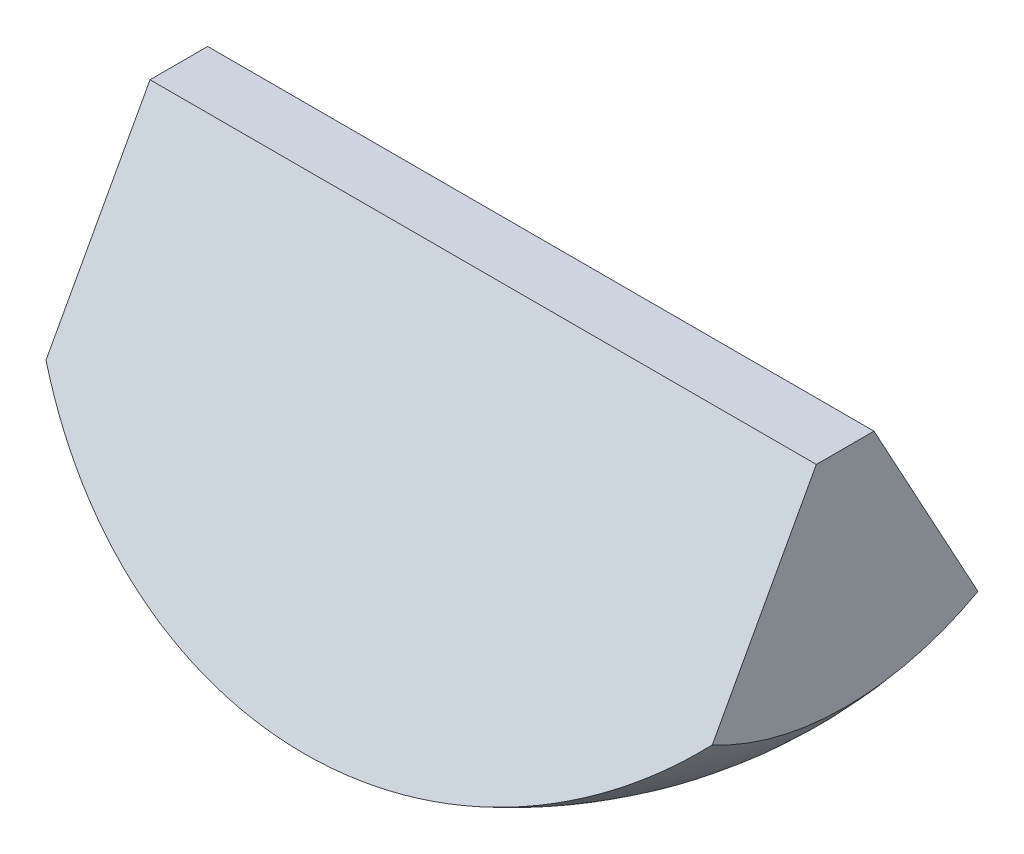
SolidWorks part; units mm, degrees
ref_plane "前视基准面" through (0, 0, 0) normal (0, 0, 1) x (1, 0, 0)
ref_plane "上视基准面" through (0, 0, 0) normal (0, 1, 0) x (1, 0, 0)
ref_plane "右视基准面" through (0, 0, 0) normal (1, 0, 0) x (0, 0, -1)
sketch "草图2" plane through (0, 0, 0) normal (0, 0, 1) x (1, 0, 0)
  line L0 (0, 41) -> (0, -41)
  arc A0 (0, -41) -> (0, 41) centre (0, 0) ccw
  dimension "D1" = 82
revolve "旋转1" add sketch "草图2" angle 360 about L0
sketch "草图5" plane through (0, 0, 0) normal (0, 0, 1) x (1, 0, 0)
  line L0 (-65.3764, -5) -> (89.469, -5)
  line L1 (89.469, -5) -> (89.469, 60.6775)
  line L2 (89.469, 60.6775) -> (-65.3764, 60.6775)
  line L3 (-65.3764, 60.6775) -> (-65.3764, -5)
  dimension "D1" = 5
extrude "切除-拉伸2" cut sketch "草图5" against normal mid plane 100
sketch "草图6" plane through (0, -5, 0) normal (0, 1, 0) x (1, 0, 0)
  line L0 (-31.5, 34.9289) -> (-31.5, -35.4573)
  line L1 (-31.5, -35.4573) -> (-61.1975, -1.3211)
  line L2 (-61.1975, -1.3211) -> (-31.5, 34.9289)
  line L3 (31.5, 34.9289) -> (31.5, -41.9041)
  line L4 (31.5, -41.9041) -> (60.9861, -2.8007)
  line L5 (60.9861, -2.8007) -> (31.5, 34.9289)
  dimension "D1" = 31.5
  dimension "D2" = 31.5
extrude "切除-拉伸3" cut sketch "草图6" against normal mid plane 190
sketch "草图7" plane through (0, 0, 0) normal (1, 0, 0) x (0, 0, -1)
  line L0 (0, 0) -> (19.6214, -36)
  line L1 (25.7633, -5) -> (-25.7633, -5) construction
  line L2 (0, 0) -> (0, -47.3772) construction
  line L3 (0, 0) -> (-19.6214, -36)
  line L4 (19.6214, -36) -> (19.6214, -53.5021)
  line L5 (19.6214, -53.5021) -> (-19.6214, -53.5021)
  line L6 (-19.6214, -53.5021) -> (-19.6214, -36)
  arc A0 (-40.694, -5) -> (40.694, -5) centre (0, 0) ccw construction
  dimension "D1" = 31
extrude "切除-拉伸4" cut sketch "草图7" against normal mid plane 240 flip side to cut
